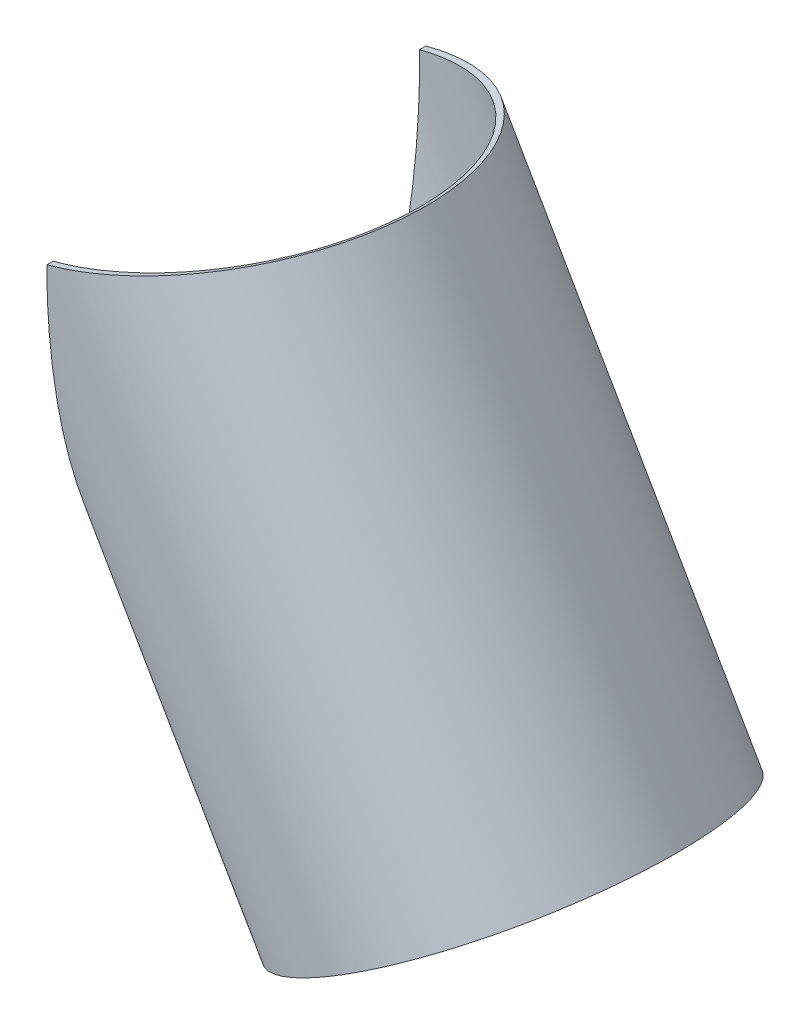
SolidWorks part; units mm, degrees
ref_plane "前视基准面" through (0, 0, 0) normal (0, 0, 1) x (1, 0, 0)
ref_plane "上视基准面" through (0, 0, 0) normal (0, 1, 0) x (1, 0, 0)
ref_plane "右视基准面" through (0, 0, 0) normal (1, 0, 0) x (0, 0, -1)
imported_body "基体零件-Y形管-1"
sheet metal parameters "钣金1" parameters "D1"=0.7366, "厚度"=4
bend "圆角折弯1" bend radius 116 bend angle 359.523 parameters "D5"=1
flatten bends "展开-折弯1"
sketch "尖角-草图1" plane through (35.5389, -301.5531, 0.5) normal (-0.866, -0.5, 0.0042) x (0.0036, 0.0021, 1)
  line L0 (363.9414, 71.0779) -> (363.9414, -71.0779) construction
  dimension "D1" = 0
process bends "加工-折弯1" parameters "D1"=0
sketch "平面-草图1" plane through (35.5389, -301.5531, 0.5) normal (-0.866, -0.5, 0.0042) x (0.0036, 0.0021, 1)
